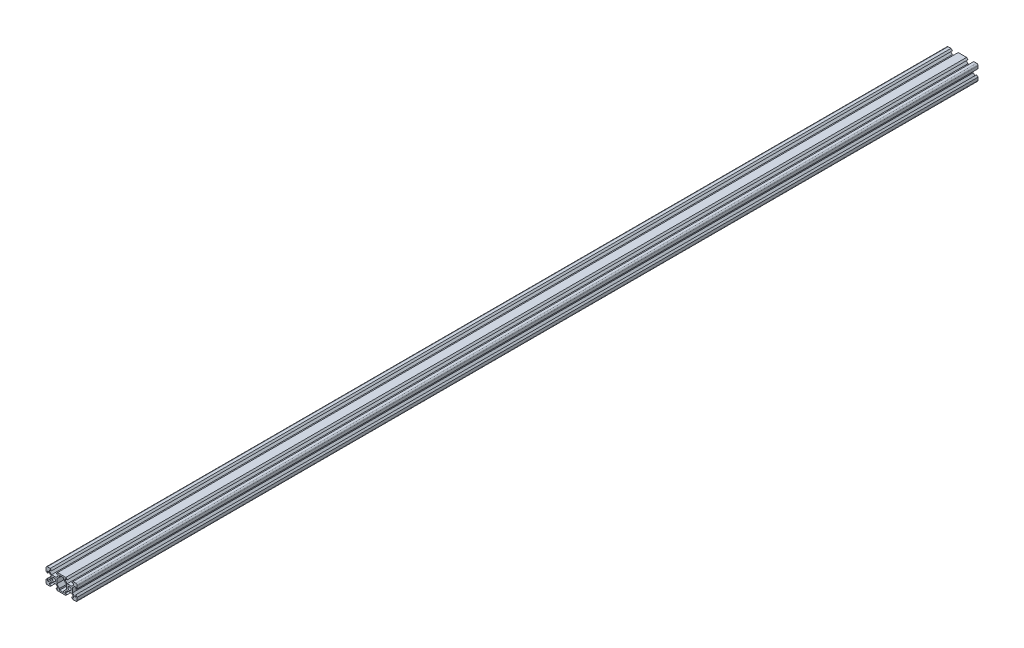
SolidWorks part; units mm, degrees
ref_plane "Front Plane" through (0, 0, 0) normal (0, 0, 1) x (1, 0, 0)
ref_plane "Top Plane" through (0, 0, 0) normal (0, 1, 0) x (1, 0, 0)
ref_plane "Right Plane" through (0, 0, 0) normal (1, 0, 0) x (0, 0, -1)
imported_body "Imported1"
sketch "Sketch1" plane through (0, 0, 25.4) normal (0, 0, 1) x (1, 0, 0)
  line L64 (-15.4993, -8.2) -> (-15.4993, -6.56)
  line L65 (-15.4993, -6.56) -> (-12.84, -3.9007)
  line L66 (-12.84, -3.9007) -> (-7.16, -3.9007)
  line L67 (-7.16, -3.9007) -> (-4.5007, -6.56)
  line L68 (-4.5007, -6.56) -> (-4.5007, -8.2)
  line L69 (-4.5007, -8.2) -> (-7.16, -8.2)
  line L70 (-7.16, -8.2) -> (-5.36, -10)
  line L71 (-5.36, -10) -> (5.36, -10)
  line L72 (5.36, -10) -> (7.16, -8.2)
  line L73 (7.16, -8.2) -> (4.5007, -8.2)
  line L74 (4.5007, -8.2) -> (4.5007, -6.56)
  line L75 (4.5007, -6.56) -> (7.16, -3.9007)
  line L76 (7.16, -3.9007) -> (12.84, -3.9007)
  line L77 (12.84, -3.9007) -> (15.4993, -6.56)
  line L78 (15.4993, -6.56) -> (15.4993, -8.2)
  line L79 (15.4993, -8.2) -> (12.84, -8.2)
  line L80 (12.84, -8.2) -> (14.64, -10)
  line L81 (14.64, -10) -> (18.2, -10)
  line L82 (20, -8.2) -> (20, -4.64)
  line L83 (20, -4.64) -> (18.2, -2.84)
  line L84 (18.2, -2.84) -> (18.2, -5.4993)
  line L85 (18.2, -5.4993) -> (16.56, -5.4993)
  line L86 (16.56, -5.4993) -> (13.9007, -2.84)
  line L87 (13.9007, -2.84) -> (13.9007, 2.84)
  line L88 (13.9007, 2.84) -> (16.56, 5.4993)
  line L89 (16.56, 5.4993) -> (18.2, 5.4993)
  line L90 (18.2, 5.4993) -> (18.2, 2.84)
  line L91 (18.2, 2.84) -> (20, 4.64)
  line L92 (20, 4.64) -> (20, 8.2)
  line L93 (18.2, 10) -> (14.64, 10)
  line L94 (14.64, 10) -> (12.84, 8.2)
  line L95 (12.84, 8.2) -> (15.4993, 8.2)
  line L96 (15.4993, 8.2) -> (15.4993, 6.56)
  line L97 (15.4993, 6.56) -> (12.84, 3.9007)
  line L98 (12.84, 3.9007) -> (7.16, 3.9007)
  line L99 (7.16, 3.9007) -> (4.5007, 6.56)
  line L100 (4.5007, 6.56) -> (4.5007, 8.2)
  line L101 (4.5007, 8.2) -> (7.16, 8.2)
  line L102 (7.16, 8.2) -> (5.36, 10)
  line L103 (5.36, 10) -> (-5.36, 10)
  line L104 (-5.36, 10) -> (-7.16, 8.2)
  line L105 (-7.16, 8.2) -> (-4.5007, 8.2)
  line L106 (-4.5007, 8.2) -> (-4.5007, 6.56)
  line L107 (-4.5007, 6.56) -> (-7.16, 3.9007)
  line L108 (-7.16, 3.9007) -> (-12.84, 3.9007)
  line L109 (-12.84, 3.9007) -> (-15.4993, 6.56)
  line L110 (-15.4993, 6.56) -> (-15.4993, 8.2)
  line L111 (-15.4993, 8.2) -> (-12.84, 8.2)
  line L112 (-12.84, 8.2) -> (-14.64, 10)
  line L113 (-14.64, 10) -> (-18.2, 10)
  line L114 (-20, 8.2) -> (-20, 4.64)
  line L115 (-20, 4.64) -> (-18.2, 2.84)
  line L116 (-18.2, 2.84) -> (-18.2, 5.4993)
  line L117 (-18.2, 5.4993) -> (-16.56, 5.4993)
  line L118 (-16.56, 5.4993) -> (-13.9007, 2.84)
  line L119 (-13.9007, 2.84) -> (-13.9007, -2.84)
  line L120 (-13.9007, -2.84) -> (-16.56, -5.4993)
  line L121 (-16.56, -5.4993) -> (-18.2, -5.4993)
  line L122 (-18.2, -5.4993) -> (-18.2, -2.84)
  line L123 (-18.2, -2.84) -> (-20, -4.64)
  line L124 (-20, -4.64) -> (-20, -8.2)
  line L125 (-18.2, -10) -> (-14.64, -10)
  line L126 (-14.64, -10) -> (-12.84, -8.2)
  line L127 (-12.84, -8.2) -> (-15.4993, -8.2)
  line L128 (-15.4993, -8.2) -> (-15.4993, -6.56)
  line L129 (-15.4993, -6.56) -> (-12.84, -3.9007)
  line L130 (-12.84, -3.9007) -> (-7.16, -3.9007)
  line L131 (-7.16, -3.9007) -> (-4.5007, -6.56)
  line L132 (-4.5007, -6.56) -> (-4.5007, -8.2)
  line L133 (-4.5007, -8.2) -> (-7.16, -8.2)
  line L134 (-7.16, -8.2) -> (-5.36, -10)
  line L135 (-5.36, -10) -> (5.36, -10)
  line L136 (5.36, -10) -> (7.16, -8.2)
  line L137 (7.16, -8.2) -> (4.5007, -8.2)
  line L138 (4.5007, -8.2) -> (4.5007, -6.56)
  line L139 (4.5007, -6.56) -> (7.16, -3.9007)
  line L140 (7.16, -3.9007) -> (12.84, -3.9007)
  line L141 (12.84, -3.9007) -> (15.4993, -6.56)
  line L142 (15.4993, -6.56) -> (15.4993, -8.2)
  line L143 (15.4993, -8.2) -> (12.84, -8.2)
  line L144 (12.84, -8.2) -> (14.64, -10)
  line L145 (14.64, -10) -> (18.2, -10)
  line L146 (20, -8.2) -> (20, -4.64)
  line L147 (20, -4.64) -> (18.2, -2.84)
  line L148 (18.2, -2.84) -> (18.2, -5.4993)
  line L149 (18.2, -5.4993) -> (16.56, -5.4993)
  line L150 (16.56, -5.4993) -> (13.9007, -2.84)
  line L151 (13.9007, -2.84) -> (13.9007, 2.84)
  line L152 (13.9007, 2.84) -> (16.56, 5.4993)
  line L153 (16.56, 5.4993) -> (18.2, 5.4993)
  line L154 (18.2, 5.4993) -> (18.2, 2.84)
  line L155 (18.2, 2.84) -> (20, 4.64)
  line L156 (20, 4.64) -> (20, 8.2)
  line L157 (18.2, 10) -> (14.64, 10)
  line L158 (14.64, 10) -> (12.84, 8.2)
  line L159 (12.84, 8.2) -> (15.4993, 8.2)
  line L160 (15.4993, 8.2) -> (15.4993, 6.56)
  line L161 (15.4993, 6.56) -> (12.84, 3.9007)
  line L162 (12.84, 3.9007) -> (7.16, 3.9007)
  line L163 (7.16, 3.9007) -> (4.5007, 6.56)
  line L164 (4.5007, 6.56) -> (4.5007, 8.2)
  line L165 (4.5007, 8.2) -> (7.16, 8.2)
  line L166 (7.16, 8.2) -> (5.36, 10)
  line L167 (5.36, 10) -> (-5.36, 10)
  line L168 (-5.36, 10) -> (-7.16, 8.2)
  line L169 (-7.16, 8.2) -> (-4.5007, 8.2)
  line L170 (-4.5007, 8.2) -> (-4.5007, 6.56)
  line L171 (-4.5007, 6.56) -> (-7.16, 3.9007)
  line L172 (-7.16, 3.9007) -> (-12.84, 3.9007)
  line L173 (-12.84, 3.9007) -> (-15.4993, 6.56)
  line L174 (-15.4993, 6.56) -> (-15.4993, 8.2)
  line L175 (-15.4993, 8.2) -> (-12.84, 8.2)
  line L176 (-12.84, 8.2) -> (-14.64, 10)
  line L177 (-14.64, 10) -> (-18.2, 10)
  line L178 (-20, 8.2) -> (-20, 4.64)
  line L179 (-20, 4.64) -> (-18.2, 2.84)
  line L180 (-18.2, 2.84) -> (-18.2, 5.4993)
  line L181 (-18.2, 5.4993) -> (-16.56, 5.4993)
  line L182 (-16.56, 5.4993) -> (-13.9007, 2.84)
  line L183 (-13.9007, 2.84) -> (-13.9007, -2.84)
  line L184 (-13.9007, -2.84) -> (-16.56, -5.4993)
  line L185 (-16.56, -5.4993) -> (-18.2, -5.4993)
  line L186 (-18.2, -5.4993) -> (-18.2, -2.84)
  line L187 (-18.2, -2.84) -> (-20, -4.64)
  line L188 (-20, -4.64) -> (-20, -8.2)
  line L189 (-18.2, -10) -> (-14.64, -10)
  line L190 (-14.64, -10) -> (-12.84, -8.2)
  line L191 (-12.84, -8.2) -> (-15.4993, -8.2)
  line L322 (-2.6993, 8.2) -> (-2.6993, 6.24) construction
  line L323 (2.6993, 8.2) -> (-2.6993, 8.2) construction
  line L324 (2.6993, 6.24) -> (2.6993, 8.2) construction
  line L325 (6.0993, 2.84) -> (2.6993, 6.24) construction
  line L326 (6.0993, -2.84) -> (6.0993, 2.84) construction
  line L327 (2.6993, -6.24) -> (6.0993, -2.84) construction
  line L328 (2.6993, -8.2) -> (2.6993, -6.24) construction
  line L329 (-2.6993, -8.2) -> (2.6993, -8.2) construction
  line L330 (-2.6993, -6.24) -> (-2.6993, -8.2) construction
  line L331 (-6.0993, -2.84) -> (-2.6993, -6.24) construction
  line L332 (-6.0993, 2.84) -> (-6.0993, -2.84) construction
  line L333 (-2.6993, 6.24) -> (-6.0993, 2.84) construction
  line L334 (-2.6993, 8.2) -> (-2.6993, 6.24)
  line L335 (2.6993, 8.2) -> (-2.6993, 8.2)
  line L336 (2.6993, 6.24) -> (2.6993, 8.2)
  line L337 (6.0993, 2.84) -> (2.6993, 6.24)
  line L338 (6.0993, -2.84) -> (6.0993, 2.84)
  line L339 (2.6993, -6.24) -> (6.0993, -2.84)
  line L340 (2.6993, -8.2) -> (2.6993, -6.24)
  line L341 (-2.6993, -8.2) -> (2.6993, -8.2)
  line L342 (-2.6993, -6.24) -> (-2.6993, -8.2)
  line L343 (-6.0993, -2.84) -> (-2.6993, -6.24)
  line L344 (-6.0993, 2.84) -> (-6.0993, -2.84)
  line L345 (-2.6993, 6.24) -> (-6.0993, 2.84)
  circle A1 centre (-10, 0) radius 2.1
  circle A2 centre (-10, 0) radius 2.1
  circle A3 centre (10, 0) radius 2.1
  circle A4 centre (10, 0) radius 2.1
  arc A8 (18.2, -10) -> (20, -8.2) centre (18.2, -8.2) ccw
  arc A9 (20, 8.2) -> (18.2, 10) centre (18.2, 8.2) ccw
  arc A10 (-18.2, 10) -> (-20, 8.2) centre (-18.2, 8.2) ccw
  arc A11 (-20, -8.2) -> (-18.2, -10) centre (-18.2, -8.2) ccw
  arc A12 (18.2, -10) -> (20, -8.2) centre (18.2, -8.2) ccw
  arc A13 (20, 8.2) -> (18.2, 10) centre (18.2, 8.2) ccw
  arc A14 (-18.2, 10) -> (-20, 8.2) centre (-18.2, 8.2) ccw
  arc A15 (-20, -8.2) -> (-18.2, -10) centre (-18.2, -8.2) ccw
  dimension "D1" = 0
  dimension "D2" = 0
  dimension "D3" = 0
extrude "Boss-Extrude1" add sketch "Sketch1" along normal blind 1128.4001
ref_plane "Plane1" through (0, 0, 0) normal (0, 1, 0) x (-1, 0, 0)
